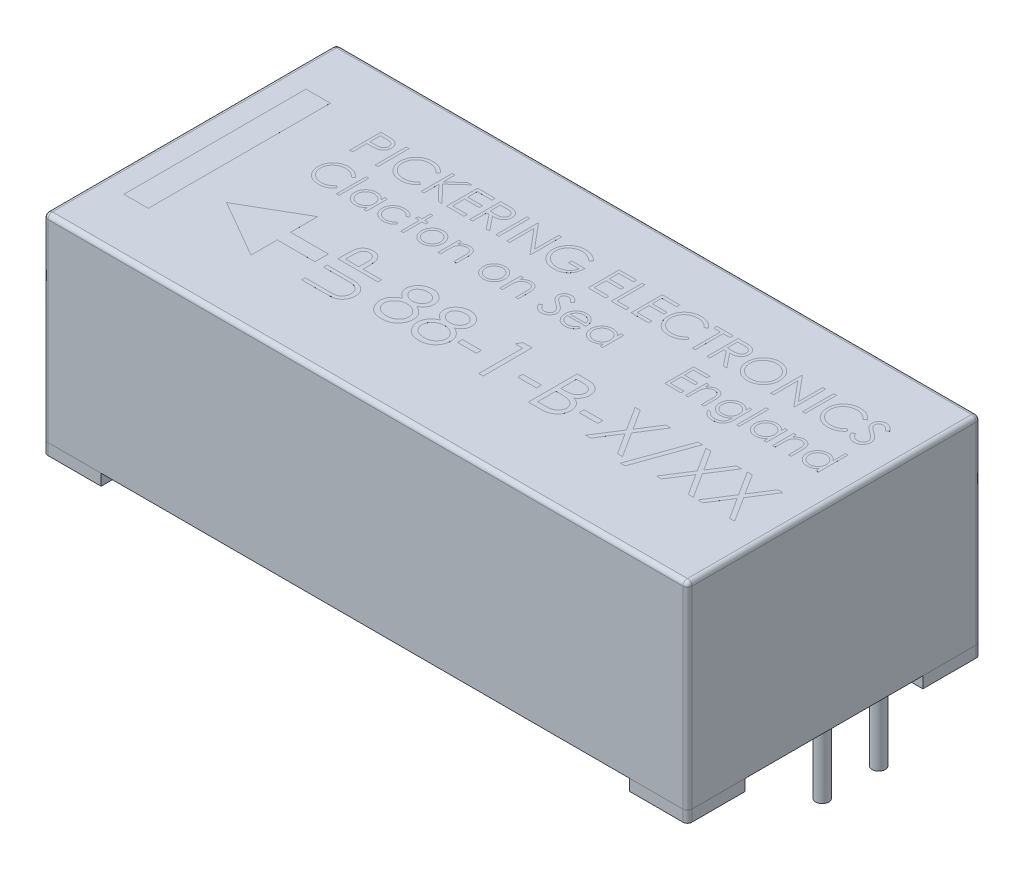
SolidWorks part; units mm, degrees
ref_plane "Front Plane" through (0, 0, 0) normal (0, 0, 1) x (1, 0, 0)
ref_plane "Top Plane" through (0, 0, 0) normal (0, 1, 0) x (1, 0, 0)
ref_plane "Right Plane" through (0, 0, 0) normal (1, 0, 0) x (0, 0, -1)
sketch "Sketch2" plane through (0, 0, 0) normal (0, 1, 0) x (1, 0, 0)
  line L1 (14.5, -6.6) -> (-14.5, -6.6)
  line L2 (14.5, -6.6) -> (14.5, 6.6)
  line L3 (14.5, 6.6) -> (-14.5, 6.6)
  line L4 (-14.5, -6.6) -> (-14.5, 6.6)
  line L5 (14.5, -6.6) -> (-14.5, 6.6) construction
  line L6 (14.5, 6.6) -> (-14.5, -6.6) construction
  point P0 (0, 0)
  dimension "D1" = 13.2
  dimension "D2" = 29
extrude "Main Body" add sketch "Sketch2" along normal blind 8.89 draft 0.023
sketch "Sketch9" plane through (0, 0, 0) normal (0, -1, 0) x (1, 0, 0)
  line L0 (14.5, -6.6) -> (-14.5, -6.6) construction
  line L1 (14.5, 6.6) -> (14.5, -6.6) construction
  circle A0 centre (12.7, -3.81) radius 0.3
  circle A1 centre (12.7, -1.27) radius 0.2963
  dimension "D1" = 0.6
  dimension "D2" = 2.79
  dimension "D3" = 2.54
  dimension "D4" = 1.8
extrude "Pins" add sketch "Sketch9" along normal blind 4.31
mirror "Mirror2" about plane through (0, 0, 0) normal (1, 0, 0) of "Pins"
sketch "Sketch10" plane through (0, 0, 0) normal (0, -1, 0) x (1, 0, 0)
  line L1 (14.5, 6.6) -> (11.9, 6.6)
  line L2 (14.5, 6.6) -> (14.5, 4)
  line L3 (14.5, 4) -> (11.9, 4)
  line L4 (11.9, 6.6) -> (11.9, 4)
  dimension "D1" = 2.6
  dimension "D2" = 2.6
extrude "Foot" add sketch "Sketch10" along normal blind 0.51
sketch "Sketch11" plane through (0, -0.51, 0) normal (0, -1, 0) x (1, 0, 0)
  line L0 (14.5, 6.6) -> (11.9, 6.6) construction
  line L1 (11.9, 4) -> (13.95, 4)
  line L2 (11.9, 4) -> (11.9, 6.05)
  line L3 (11.9, 6.05) -> (13.95, 6.05)
  line L4 (13.95, 4) -> (13.95, 6.05)
  line L5 (14.5, 4) -> (14.5, 6.6) construction
  dimension "D1" = 0.55
  dimension "D2" = 0.55
extrude "Extrude2" cut sketch "Sketch11" against normal up to surface (0.51 mm away)
mirror "Mirror3" about plane through (0, 0, 0) normal (0, 0, 1) of "Extrude2", "Foot"
mirror "Mirror4" about plane through (0, 0, 0) normal (1, 0, 0) of "Mirror3", "Foot", "Extrude2"
sketch "Sketch12"
  dimension "D1" = 1.1
  dimension "D2" = 8.2
  dimension "D3" = 2.4965
  dimension "D4" = 1.4
  dimension "D5" = 2
  dimension "D6" = 3.8
extrude "Lettering" add sketch "Sketch12" along normal blind 0.0001
fillet "Fillet1" radius 0.2 12 edges at (-14.5, -0.255, -6.6) (-14.5, -0.255, 6.6) (14.5, -0.255, -6.6) (14.5, -0.255, 6.6) (-14.4983, 4.445, -6.5983) (-14.4983, 4.445, 6.5983) (14.4983, 4.445, -6.5983) (14.4983, 4.445, 6.5983) (14.4965, 8.89, 0) (0, 8.89, -6.5965) (-14.4965, 8.89, 0) (0, 8.89, 6.5965)
sketch "Sketch13"
sketch_block_instance "UP-1"
sketch_block "UP"
sketch_block_instance "Block1-1"
sketch_block "Block1" parameters "D1"=1.7, "D2"=2.2, "D3"=2.6, "D4"=1.24
extrude "Extrude3" add sketch "Sketch13" along normal blind 0.0001
